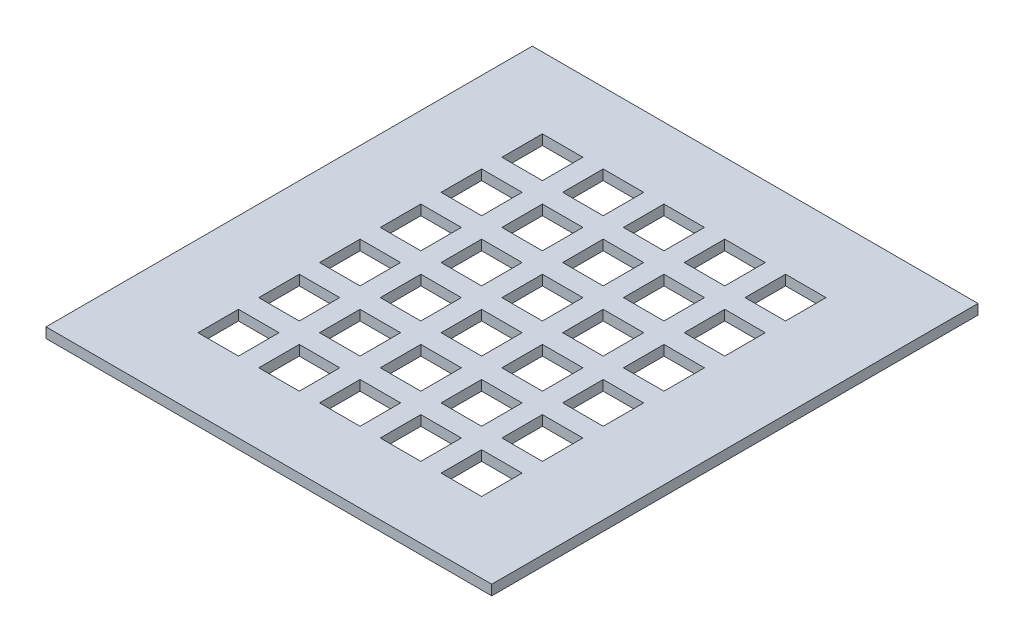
SolidWorks part; units mm, degrees
ref_plane "Front Plane" through (0, 0, 0) normal (0, 0, 1) x (1, 0, 0)
ref_plane "Top Plane" through (0, 0, 0) normal (0, 1, 0) x (1, 0, 0)
ref_plane "Right Plane" through (0, 0, 0) normal (1, 0, 0) x (0, 0, -1)
sketch "Sketch1" plane through (0, 0, 0) normal (0, 0, 1) x (1, 0, 0)
  line L1 (69.85, -1.5875) -> (-69.85, -1.5875)
  line L2 (69.85, -1.5875) -> (69.85, 1.5875)
  line L3 (69.85, 1.5875) -> (-69.85, 1.5875)
  line L4 (-69.85, -1.5875) -> (-69.85, 1.5875)
  line L5 (69.85, -1.5875) -> (-69.85, 1.5875) construction
  line L6 (69.85, 1.5875) -> (-69.85, -1.5875) construction
  point P0 (0, 0)
  dimension "D1" = 3.175
  dimension "D2" = 139.7
extrude "Boss-Extrude1" add sketch "Sketch1" along normal mid plane 152.4
sketch "Sketch2" plane through (0, 1.5875, 0) normal (0, 1, 0) x (1, 0, 0)
  line L0 (31.75, -53.975) -> (31.75, -41.275)
  line L1 (31.75, -53.975) -> (44.45, -53.975)
  line L2 (44.45, -53.975) -> (44.45, -41.275)
  line L3 (31.75, -41.275) -> (44.45, -41.275)
  line L4 (31.75, -53.975) -> (44.45, -41.275) construction
  line L5 (44.45, -53.975) -> (38.1, -47.625) construction
  line L6 (44.45, -34.925) -> (44.45, -22.225)
  line L7 (31.75, -22.225) -> (44.45, -22.225)
  line L8 (31.75, -34.925) -> (31.75, -22.225)
  line L9 (31.75, -34.925) -> (44.45, -34.925)
  line L10 (44.45, -15.875) -> (44.45, -3.175)
  line L11 (31.75, -3.175) -> (44.45, -3.175)
  line L12 (31.75, -15.875) -> (31.75, -3.175)
  line L13 (31.75, -15.875) -> (44.45, -15.875)
  line L14 (44.45, 3.175) -> (44.45, 15.875)
  line L15 (31.75, 15.875) -> (44.45, 15.875)
  line L16 (31.75, 3.175) -> (31.75, 15.875)
  line L17 (31.75, 3.175) -> (44.45, 3.175)
  line L18 (44.45, 22.225) -> (44.45, 34.925)
  line L19 (31.75, 34.925) -> (44.45, 34.925)
  line L20 (31.75, 22.225) -> (31.75, 34.925)
  line L21 (31.75, 22.225) -> (44.45, 22.225)
  line L22 (44.45, 41.275) -> (44.45, 53.975)
  line L23 (31.75, 53.975) -> (44.45, 53.975)
  line L24 (31.75, 41.275) -> (31.75, 53.975)
  line L25 (31.75, 41.275) -> (44.45, 41.275)
  line L26 (25.4, -34.925) -> (25.4, -22.225)
  line L27 (12.7, -22.225) -> (25.4, -22.225)
  line L28 (12.7, -34.925) -> (12.7, -22.225)
  line L29 (12.7, -34.925) -> (25.4, -34.925)
  line L30 (25.4, -15.875) -> (25.4, -3.175)
  line L31 (12.7, -3.175) -> (25.4, -3.175)
  line L32 (12.7, -15.875) -> (12.7, -3.175)
  line L33 (12.7, -15.875) -> (25.4, -15.875)
  line L34 (25.4, 3.175) -> (25.4, 15.875)
  line L35 (12.7, 15.875) -> (25.4, 15.875)
  line L36 (12.7, 3.175) -> (12.7, 15.875)
  line L37 (12.7, 3.175) -> (25.4, 3.175)
  line L38 (25.4, 22.225) -> (25.4, 34.925)
  line L39 (12.7, 34.925) -> (25.4, 34.925)
  line L40 (12.7, 22.225) -> (12.7, 34.925)
  line L41 (12.7, 22.225) -> (25.4, 22.225)
  line L42 (25.4, 41.275) -> (25.4, 53.975)
  line L43 (12.7, 53.975) -> (25.4, 53.975)
  line L44 (12.7, 41.275) -> (12.7, 53.975)
  line L45 (12.7, 41.275) -> (25.4, 41.275)
  line L46 (6.35, -34.925) -> (6.35, -22.225)
  line L47 (-6.35, -22.225) -> (6.35, -22.225)
  line L48 (-6.35, -34.925) -> (-6.35, -22.225)
  line L49 (-6.35, -34.925) -> (6.35, -34.925)
  line L50 (6.35, -15.875) -> (6.35, -3.175)
  line L51 (-6.35, -3.175) -> (6.35, -3.175)
  line L52 (-6.35, -15.875) -> (-6.35, -3.175)
  line L53 (-6.35, -15.875) -> (6.35, -15.875)
  line L54 (6.35, 3.175) -> (6.35, 15.875)
  line L55 (-6.35, 15.875) -> (6.35, 15.875)
  line L56 (-6.35, 3.175) -> (-6.35, 15.875)
  line L57 (-6.35, 3.175) -> (6.35, 3.175)
  line L58 (6.35, 22.225) -> (6.35, 34.925)
  line L59 (-6.35, 34.925) -> (6.35, 34.925)
  line L60 (-6.35, 22.225) -> (-6.35, 34.925)
  line L61 (-6.35, 22.225) -> (6.35, 22.225)
  line L62 (6.35, 41.275) -> (6.35, 53.975)
  line L63 (-6.35, 53.975) -> (6.35, 53.975)
  line L64 (-6.35, 41.275) -> (-6.35, 53.975)
  line L65 (-6.35, 41.275) -> (6.35, 41.275)
  line L66 (-12.7, -34.925) -> (-12.7, -22.225)
  line L67 (-25.4, -22.225) -> (-12.7, -22.225)
  line L68 (-25.4, -34.925) -> (-25.4, -22.225)
  line L69 (-25.4, -34.925) -> (-12.7, -34.925)
  line L70 (-12.7, -15.875) -> (-12.7, -3.175)
  line L71 (-25.4, -3.175) -> (-12.7, -3.175)
  line L72 (-25.4, -15.875) -> (-25.4, -3.175)
  line L73 (-25.4, -15.875) -> (-12.7, -15.875)
  line L74 (-12.7, 3.175) -> (-12.7, 15.875)
  line L75 (-25.4, 15.875) -> (-12.7, 15.875)
  line L76 (-25.4, 3.175) -> (-25.4, 15.875)
  line L77 (-25.4, 3.175) -> (-12.7, 3.175)
  line L78 (-12.7, 22.225) -> (-12.7, 34.925)
  line L79 (-25.4, 34.925) -> (-12.7, 34.925)
  line L80 (-25.4, 22.225) -> (-25.4, 34.925)
  line L81 (-25.4, 22.225) -> (-12.7, 22.225)
  line L82 (-12.7, 41.275) -> (-12.7, 53.975)
  line L83 (-25.4, 53.975) -> (-12.7, 53.975)
  line L84 (-25.4, 41.275) -> (-25.4, 53.975)
  line L85 (-25.4, 41.275) -> (-12.7, 41.275)
  line L86 (-31.75, -34.925) -> (-31.75, -22.225)
  line L87 (-44.45, -22.225) -> (-31.75, -22.225)
  line L88 (-44.45, -34.925) -> (-44.45, -22.225)
  line L89 (-44.45, -34.925) -> (-31.75, -34.925)
  line L90 (-31.75, -15.875) -> (-31.75, -3.175)
  line L91 (-44.45, -3.175) -> (-31.75, -3.175)
  line L92 (-44.45, -15.875) -> (-44.45, -3.175)
  line L93 (-44.45, -15.875) -> (-31.75, -15.875)
  line L94 (-31.75, 3.175) -> (-31.75, 15.875)
  line L95 (-44.45, 15.875) -> (-31.75, 15.875)
  line L96 (-44.45, 3.175) -> (-44.45, 15.875)
  line L97 (-44.45, 3.175) -> (-31.75, 3.175)
  line L98 (-31.75, 22.225) -> (-31.75, 34.925)
  line L99 (-44.45, 34.925) -> (-31.75, 34.925)
  line L100 (-44.45, 22.225) -> (-44.45, 34.925)
  line L101 (-44.45, 22.225) -> (-31.75, 22.225)
  line L102 (-31.75, 41.275) -> (-31.75, 53.975)
  line L103 (-44.45, 53.975) -> (-31.75, 53.975)
  line L104 (-44.45, 41.275) -> (-44.45, 53.975)
  line L105 (-44.45, 41.275) -> (-31.75, 41.275)
  line L106 (25.4, -53.975) -> (25.4, -41.275)
  line L107 (12.7, -41.275) -> (25.4, -41.275)
  line L108 (12.7, -53.975) -> (12.7, -41.275)
  line L109 (12.7, -53.975) -> (25.4, -53.975)
  line L110 (6.35, -53.975) -> (6.35, -41.275)
  line L111 (-6.35, -41.275) -> (6.35, -41.275)
  line L112 (-6.35, -53.975) -> (-6.35, -41.275)
  line L113 (-6.35, -53.975) -> (6.35, -53.975)
  line L114 (-12.7, -53.975) -> (-12.7, -41.275)
  line L115 (-25.4, -41.275) -> (-12.7, -41.275)
  line L116 (-25.4, -53.975) -> (-25.4, -41.275)
  line L117 (-25.4, -53.975) -> (-12.7, -53.975)
  line L118 (-31.75, -53.975) -> (-31.75, -41.275)
  line L119 (-44.45, -41.275) -> (-31.75, -41.275)
  line L120 (-44.45, -53.975) -> (-44.45, -41.275)
  line L121 (-44.45, -53.975) -> (-31.75, -53.975)
  line L122 (31.75, -34.925) -> (44.45, -22.225) construction
  line L123 (44.45, -34.925) -> (38.1, -28.575) construction
  line L124 (-69.85, 76.2) -> (-69.85, -76.2) construction
  line L125 (-69.85, 76.2) -> (69.85, 76.2) construction
  line L126 (69.85, 76.2) -> (69.85, -76.2) construction
  line L127 (-69.85, -76.2) -> (69.85, -76.2) construction
  line L132 (69.85, 76.2) -> (-69.85, 76.2)
  line L133 (-69.85, 76.2) -> (-69.85, -76.2)
  line L134 (-69.85, -76.2) -> (69.85, -76.2)
  line L135 (69.85, -76.2) -> (69.85, 76.2)
  line L136 (69.85, 76.2) -> (-69.85, 76.2) construction
  line L137 (-69.85, 76.2) -> (-69.85, -76.2) construction
  line L138 (-69.85, -76.2) -> (69.85, -76.2) construction
  line L139 (69.85, -76.2) -> (69.85, 76.2) construction
  point P0 (38.1, -47.625)
  dimension "D1" = 12.7
  dimension "D2" = 12.7
  dimension "D3" = 0
extrude "Cut-Extrude1" cut sketch "Sketch2" against normal through all
ref_plane "Plane1" through (0, 0, 0) normal (1, 0, 0) x (0, 0, -1)
